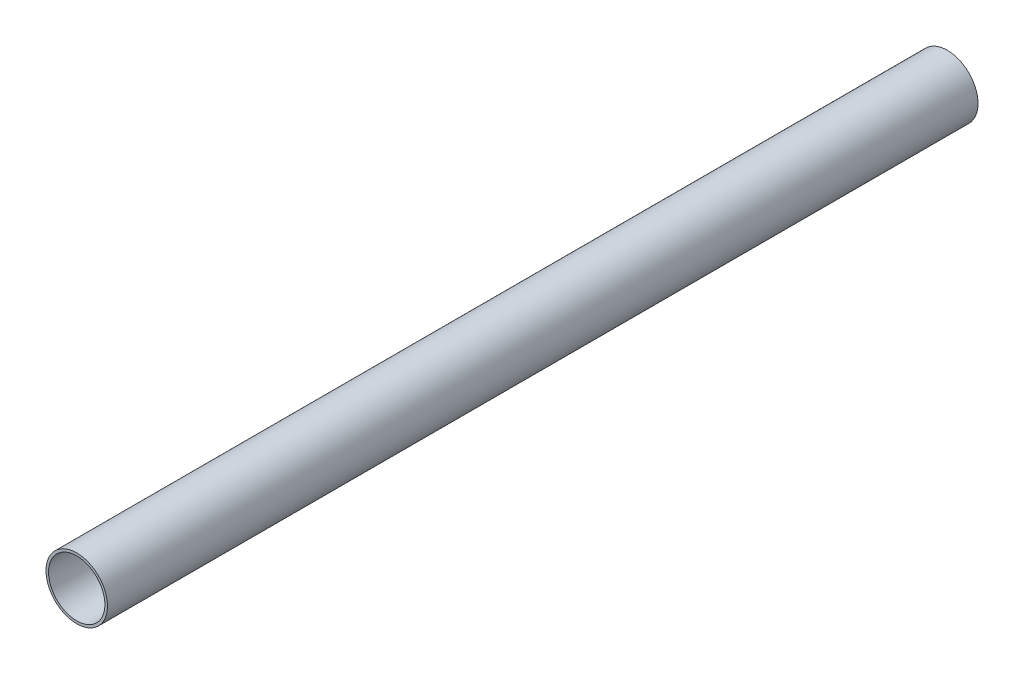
SolidWorks part; units mm, degrees
ref_plane "Plan de face" through (0, 0, 0) normal (0, 0, 1) x (1, 0, 0)
ref_plane "Plan de dessus" through (0, 0, 0) normal (0, 1, 0) x (1, 0, 0)
ref_plane "Plan de droite" through (0, 0, 0) normal (1, 0, 0) x (0, 0, -1)
sketch "Esquisse1" plane through (0, 0, 0) normal (0, 0, 1) x (1, 0, 0)
  circle A0 centre (0, 0) radius 30
  dimension "D1" = 60
extrude "Extru.-Mince1" add sketch "Esquisse1" along normal mid plane 850 thin
